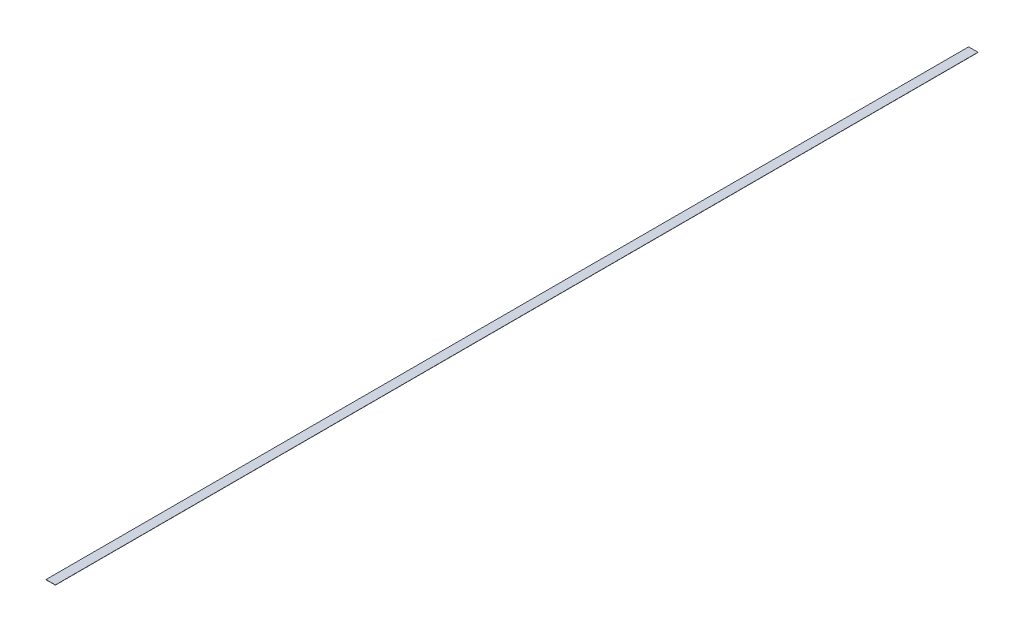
SolidWorks part; units mm, degrees
ref_plane "Front Plane" through (0, 0, 0) normal (0, 0, 1) x (1, 0, 0)
ref_plane "Top Plane" through (0, 0, 0) normal (0, 1, 0) x (1, 0, 0)
ref_plane "Right Plane" through (0, 0, 0) normal (1, 0, 0) x (0, 0, -1)
sketch "Sketch1" plane through (0, 0, 0) normal (0, 1, 0) x (1, 0, 0)
  line L1 (-76.2, 7499.3028) -> (76.2, 7499.3028)
  line L2 (-76.2, 7499.3028) -> (-76.2, -7499.3028)
  line L3 (-76.2, -7499.3028) -> (76.2, -7499.3028)
  line L4 (76.2, 7499.3028) -> (76.2, -7499.3028)
  point P4 (-76.2, 0)
  point P5 (0, 7499.3028)
  dimension "D1" = 152.4
  dimension "D2" = 14998.6056
extrude "Boss-Extrude1" add sketch "Sketch1" along normal blind 3.175
